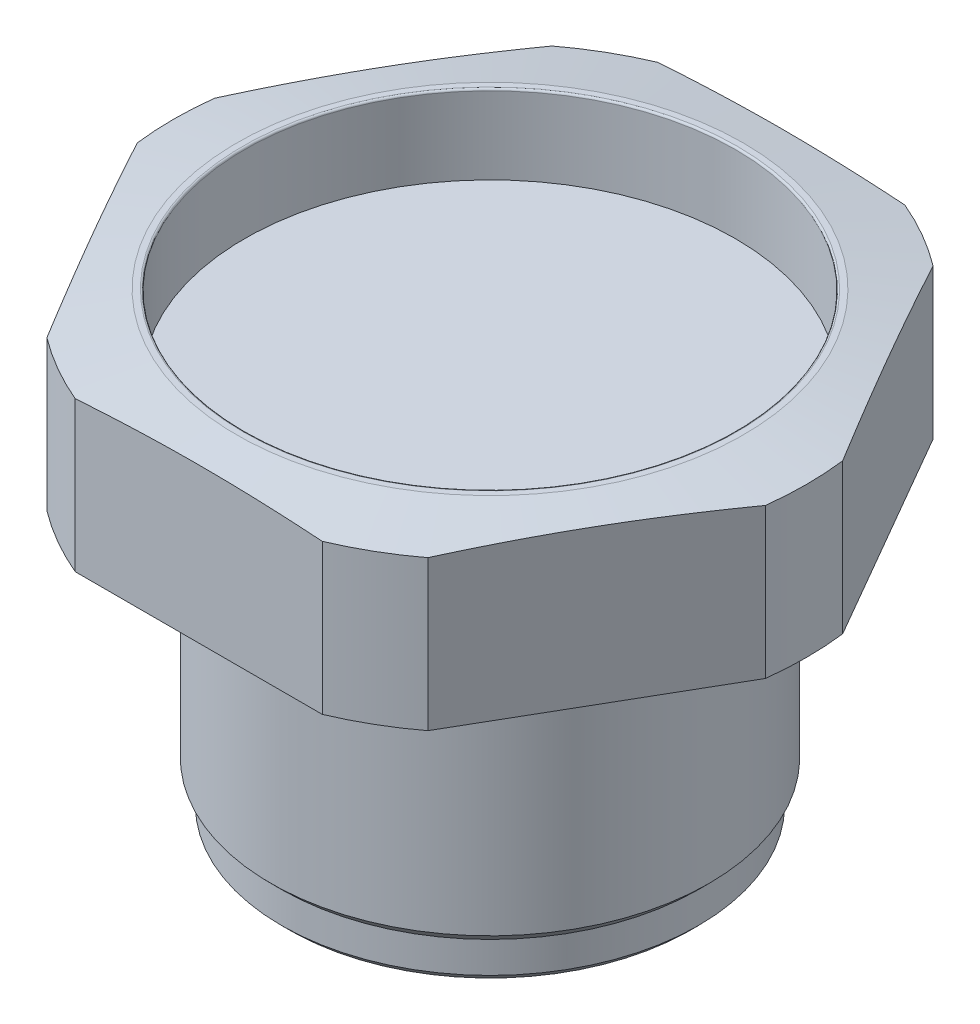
SolidWorks part; units mm, degrees
ref_plane "Front Plane" through (0, 0, 0) normal (0, 0, 1) x (1, 0, 0)
ref_plane "Top Plane" through (0, 0, 0) normal (0, 1, 0) x (1, 0, 0)
ref_plane "Right Plane" through (0, 0, 0) normal (1, 0, 0) x (0, 0, -1)
sketch "Sketch6" plane through (0, 0, 0) normal (0, 0, 1) x (1, 0, 0)
  line L0 (0, -8.9689) -> (0, 71.3762) construction
  line L1 (32.004, 21.0058) -> (33.02, 21.0058)
  line L2 (33.02, 21.0058) -> (41.275, 19.5502)
  line L3 (41.275, 19.5502) -> (41.275, 0)
  line L4 (41.275, 0) -> (27.178, 0)
  line L5 (27.178, 0) -> (27.178, -38.354)
  line L6 (27.178, -38.354) -> (0, -38.354)
  line L7 (0, -38.354) -> (0, 10.6959)
  line L8 (32.004, 21.0058) -> (32.004, 10.6959)
  line L9 (32.004, 10.6959) -> (0, 10.6959)
  dimension "D1" = 54.356
  dimension "D2" = 21.0058
  dimension "D3" = 38.354
  dimension "D4" = 82.55
  dimension "D5" = 10
  dimension "D6" = 66.04
  dimension "D7" = 10.3099
  dimension "D8" = 64.008
  dimension "D9" = 59.3598
revolve "Revolve3" add sketch "Sketch6" angle 360 about L0
fillet "Fillet7" radius 0.25 1 edges at (0, 21.0058, -32.004)
sketch "Sketch7" plane through (0, 0, 0) normal (0, -1, 0) x (1, 0, 0)
  line L0 (0, 0) -> (0, -52.3237) construction
  line L1 (-21.9384, 37.9984) -> (21.9384, 37.9984)
  line L2 (21.9384, 37.9984) -> (43.8768, 0)
  line L3 (43.8768, 0) -> (21.9384, -37.9984)
  line L4 (21.9384, -37.9984) -> (-21.9384, -37.9984)
  line L5 (-21.9384, -37.9984) -> (-43.8768, 0)
  line L6 (-43.8768, 0) -> (-21.9384, 37.9984)
  circle A0 centre (0, 0) radius 43.8768 construction
  dimension "D1" = 75.9968
extrude "Cut-Extrude5" cut sketch "Sketch7" against normal through all flip side to cut
chamfer "Chamfer2" distance 1.016 angle 45 1 edges at (0, -38.354, -27.178)
sketch "Sketch8" plane through (0, 0, 0) normal (0, 0, 1) x (1, 0, 0)
  line L0 (-27.178, -5.08) -> (-27.178, -33.274)
  line L1 (-27.178, 0) -> (-27.178, -37.338) construction
  line L2 (-27.178, -33.274) -> (-28.575, -31.877)
  line L3 (-28.575, -31.877) -> (-28.575, -6.477)
  line L4 (-28.575, -6.477) -> (-27.178, -5.08)
  line L5 (0, 0) -> (0, -37.338) construction
  line L6 (-27.178, -37.338) -> (27.178, -37.338) construction
  line L7 (-26.162, -38.354) -> (26.162, -38.354) construction
  line L9 (-24.8492, 0) -> (-40.9659, 0) construction
  dimension "D1" = 45
  dimension "D2" = 57.15
  dimension "D3" = 5.08
  dimension "D4" = 5.08
revolve "Revolve4" add sketch "Sketch8" angle 360 about L5
fillet "Fillet8" radius 0.508 1 edges at (0, 0, -27.178)
sketch "Sketch9" plane through (0, 0, 0) normal (0, 0, 1) x (1, 0, 0)
  line L0 (0, 0) -> (0, -38.354) construction
  line L1 (-26.162, -38.354) -> (26.162, -38.354) construction
  line L2 (0, -38.354) -> (0, -36.9824)
  line L3 (0, -36.9824) -> (11.2649, -36.9824)
  line L4 (11.2649, -36.9824) -> (11.2649, -38.354)
  line L5 (11.2649, -38.354) -> (0, -38.354)
  line L6 (12.573, -38.354) -> (12.573, -37.8714)
  line L7 (12.7154, -38.354) -> (12.573, -38.354)
  line L8 (14.351, -37.8714) -> (14.351, -38.354)
  line L9 (14.351, -38.354) -> (14.2086, -38.354)
  line L10 (17.2466, -36.9824) -> (22.9743, -36.9824)
  line L12 (22.2277, -38.354) -> (15.875, -38.354)
  arc A0 (17.2466, -36.9824) -> (15.875, -38.354) centre (17.2466, -38.354) ccw
  arc A1 (22.9743, -36.9824) -> (22.2277, -38.354) centre (22.9743, -37.8714) ccw
  arc A2 (12.573, -37.8714) -> (12.7154, -38.354) centre (13.462, -37.8714) ccw
  arc A3 (14.2086, -38.354) -> (14.351, -37.8714) centre (13.462, -37.8714) ccw
  point P14 (17.2466, -36.9824)
  dimension "D2" = 1.778
  dimension "D1" = 0.4826
  dimension "D3" = 45.9486
  dimension "D4" = 31.75
  dimension "D5" = 22.5298
  dimension "D6" = 26.924
revolve "Cut-Revolve1" cut sketch "Sketch9" angle 360 about L0
sketch "Sketch10" plane through (0, 0, 0) normal (0, 0, 1) x (1, 0, 0)
  line L0 (-23.857, -37.7656) -> (-22.0916, -37.7657)
  line L2 (-14.3448, -37.7662) -> (-12.5792, -37.7663)
  line L3 (0, 0) -> (0, -34.798) construction
  arc A0 (-22.2277, -38.354) -> (-22.9743, -36.9824) centre (-22.9743, -37.8714) ccw construction
  arc A1 (-23.857, -37.7656) -> (-22.0916, -37.7657) centre (-22.9743, -37.8714) ccw
  arc A2 (-14.351, -37.8714) -> (-14.2086, -38.354) centre (-13.462, -37.8714) ccw construction
  arc A5 (-14.3448, -37.7662) -> (-12.5792, -37.7663) centre (-13.462, -37.8714) ccw
revolve "Revolve6" add sketch "Sketch10" angle 360 about L3
fillet "Fillet9" radius 0.127 2 edges at (-12.573, -37.8714, 0) (-14.351, -38.354, 0)
